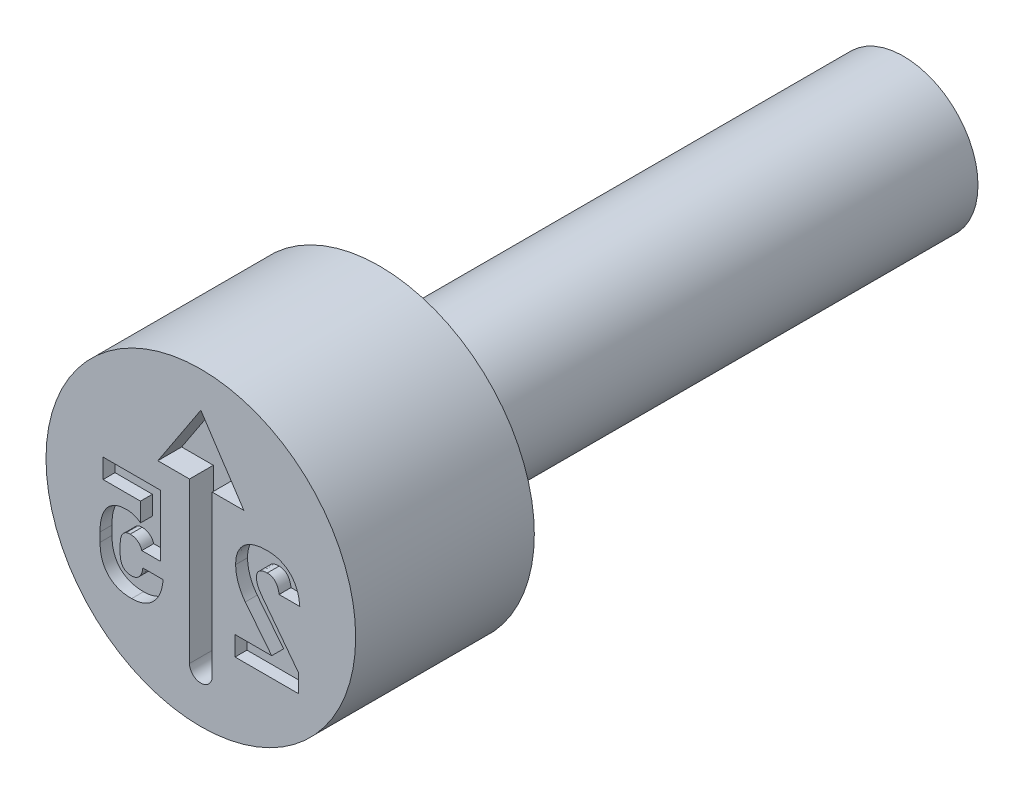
SolidWorks part; units mm, degrees
ref_plane "Front Plane" through (0, 0, 0) normal (0, 0, 1) x (1, 0, 0)
ref_plane "Top Plane" through (0, 0, 0) normal (0, 1, 0) x (1, 0, 0)
ref_plane "Right Plane" through (0, 0, 0) normal (1, 0, 0) x (0, 0, -1)
sketch "Sketch2" plane through (0, 0, 0) normal (1, 0, 0) x (0, 0, -1)
  line L0 (0.4039, 0) -> (50000.4039, 0) construction
  line L6 (0, 2.6) -> (0, 0)
  line L7 (3, 2.6) -> (0, 2.6)
  line L8 (3, 1.25) -> (3, 2.6)
  line L9 (11.8, 1.25) -> (3, 1.25)
  line L10 (11.8, 0) -> (11.8, 1.25)
  line L11 (0, 0) -> (11.8, 0)
  dimension "D1" = 5.2
  dimension "D2" = 2.5
  dimension "D3" = 11.8
  dimension "D4" = 3
revolve "Revolve1" add sketch "Sketch2" angle 360 about L0
sketch "Sketch3" plane through (0, 0, 0) normal (0, 0, 1) x (1, 0, 0)
  line L0 (0, 0) -> (0, 100000) construction
  line L1 (0.1905, 0.9064) -> (0.1905, -1.7762)
  line L2 (0.7219, 0.9064) -> (0.1905, 0.9064)
  line L3 (0, 2.0021) -> (0.7219, 0.9064)
  line L15 (0, 2.0021) -> (-0.7219, 0.9064)
  line L16 (-0.7219, 0.9064) -> (-0.1905, 0.9064)
  line L17 (-0.1905, 0.9064) -> (-0.1905, -1.7762)
  arc A2 (-0.1905, -1.7762) -> (0.1905, -1.7762) centre (0, -1.7762) ccw
extrude "Cut-Extrude4" cut sketch "Sketch3" against normal blind 0.4
sketch "Sketch4" plane through (0, 0, 0) normal (0, 0, 1) x (1, 0, 0)
  text T0 "2  5" font "Bahnschrift" height 1.8
  dimension "D1" = 1.3
extrude "Cut-Extrude5" cut sketch "Sketch4" against normal blind 0.2
